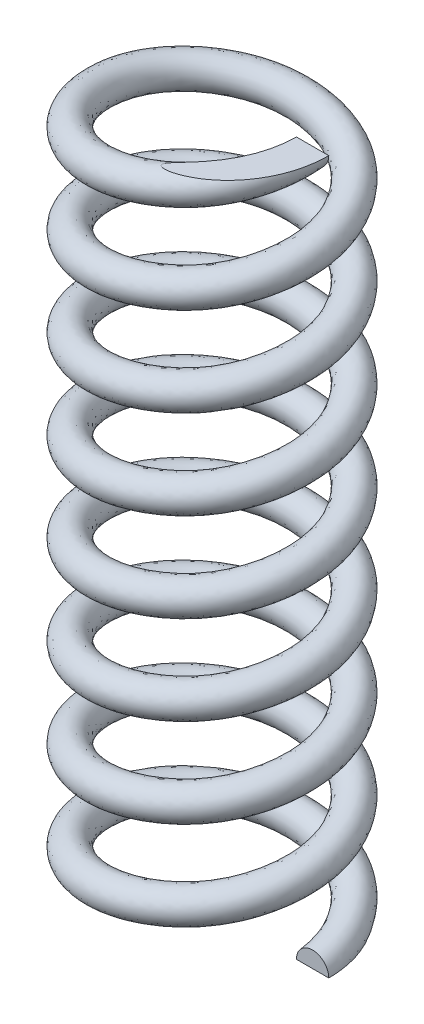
SolidWorks part; units mm, degrees
ref_plane "Front Plane" through (0, 0, 0) normal (0, 0, 1) x (1, 0, 0)
ref_plane "Top Plane" through (0, 0, 0) normal (0, 1, 0) x (1, 0, 0)
ref_plane "Right Plane" through (0, 0, 0) normal (1, 0, 0) x (0, 0, -1)
sketch "Sketch3" plane through (0, 0, -7.5) normal (0, 0, 1) x (1, 0, 0)
  circle A0 centre (6.2142, 28.145) radius 1
sketch "Sketch4" plane through (0, 0, -7.5) normal (0, 0, 1) x (1, 0, 0)
  line L0 (0, 28.145) -> (0, 72.145)
  line L8 (7.5, 28.145) -> (-7.5, 28.145) construction
  line L10 (-10, 72.145) -> (-8, 72.145) construction
  line L11 (8.25, 72.145) -> (-8.25, 72.145) construction
sweep "Sweep1" add profiles "Sketch3" path "Sketch4" parameters "D1"=2880
sketch "Sketch5" plane through (0, 0, -7.5) normal (0, 0, 1) x (1, 0, 0)
  line L0 (-8, 72.145) -> (8, 72.145) construction
  line L1 (-8, 72.145) -> (8, 72.145)
extrude "Cut-Extrude1" cut sketch "Sketch5" against normal through all and the other way through all
sketch "Sketch6" plane through (0, 0, -7.5) normal (0, 0, 1) x (1, 0, 0)
  line L0 (7.5, 28.145) -> (-7.5, 28.145) construction
  line L1 (7.5, 28.145) -> (-7.5, 28.145)
extrude "Cut-Extrude2" cut sketch "Sketch6" against normal through all and the other way through all
